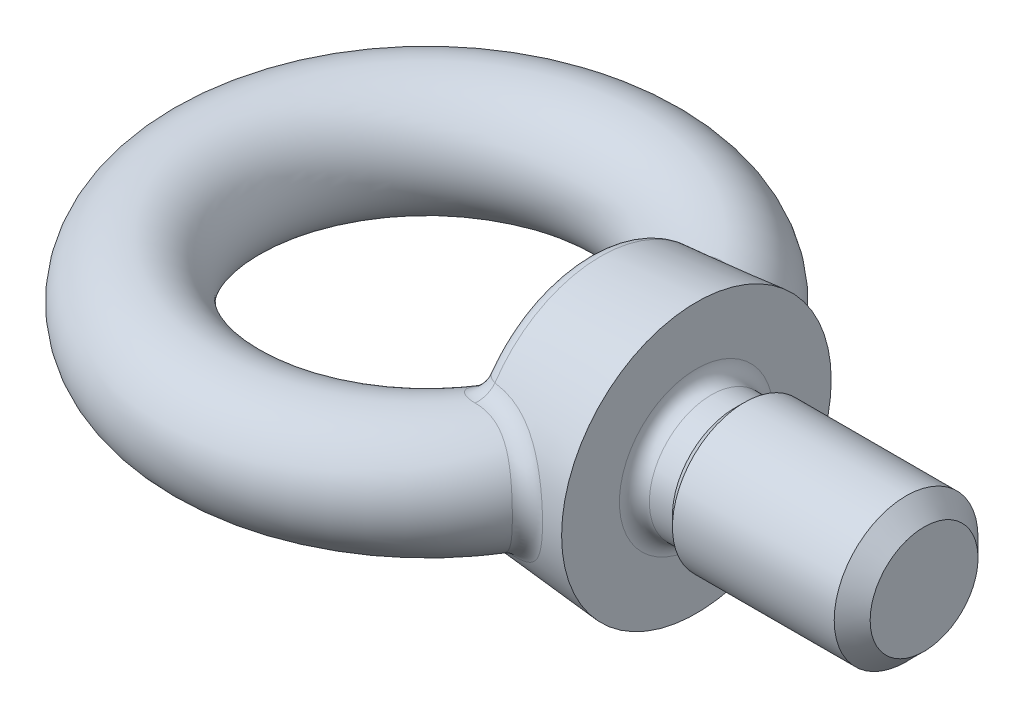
SolidWorks part; units mm, degrees
ref_plane "Front Plane" through (0, 0, 0) normal (0, 0, 1) x (1, 0, 0)
ref_plane "Top Plane" through (0, 0, 0) normal (0, 1, 0) x (1, 0, 0)
ref_plane "Right Plane" through (0, 0, 0) normal (1, 0, 0) x (0, 0, -1)
other "Configuration Table"
sketch "BaseBodySke" plane through (0, 0, 0) normal (0, 0, 1) x (1, 0, 0)
  line L0 (-107.4075, 0) -> (214.0904, 0) construction
  line L1 (0, 0) -> (0, 10.352)
  line L2 (8, 12) -> (6.352, 10.352)
  line L3 (6.352, 10.352) -> (0, 10.352)
  line L4 (8, 12) -> (38, 12)
  line L5 (38, 12) -> (38, 0)
  line L6 (38, 0) -> (0, 0)
  line L7 (8, 24.2031) -> (8, -17.9005) construction
  line L8 (34.0602, 10.352) -> (57.5082, 10.352) construction
  line L9 (35, 13.8049) -> (35, -14.5195) construction
revolve "BaseBody" add sketch "BaseBodySke" angle 360 about L6
sketch "HeadBaseSke" plane through (0, 0, 0) normal (0, 0, 1) x (1, 0, 0)
  line L0 (0, 0) -> (-36.296, 0) construction
  line L1 (-18, 20.9252) -> (0, 22.5)
  line L2 (-20, 0) -> (0, 0)
  line L3 (-45, 33.5024) -> (-45, -15.844) construction
  line L4 (0, 22.5) -> (0, 0)
  line L5 (-20, 0) -> (-18, 20.9252)
revolve "HeadBase" add sketch "HeadBaseSke" angle 360 about L0
sketch "RingSke" plane through (0, 0, 0) normal (0, 0, 1) x (1, 0, 0)
  line L0 (-45, 45.564) -> (-45, -44.2909) construction
  line L1 (0, 29.3194) -> (0, -32.008) construction
  circle A0 centre (-10, 0) radius 10
revolve "Ring" add sketch "RingSke" angle 360 about L0
sketch "FlatEndSke" plane through (0, 0, 0) normal (0, 0, 1) x (1, 0, 0)
  line L0 (35, 12) -> (38, 12)
  line L1 (38, 12) -> (38, 9)
  line L2 (38, 9) -> (35, 12)
  line L3 (38, -12) -> (38, 12) construction
  line L5 (0, 0) -> (89.7899, 0) construction
revolve "FlatEnd" cut sketch "FlatEndSke" angle 360 about L5
sketch "CutEndSke" plane through (38, 0, 0) normal (1, 0, 0) x (0, 0, -1)
  circle A0 centre (0, 0) radius 12 construction
  circle A1 centre (0, 0) radius 12
extrude "CutEnd" [suppressed] cut sketch "CutEndSke" against normal blind 3
dome "RoundEnd" [suppressed] faces to dome 1 distance 3 parameters "D1"=3
fillet "Fillet1" radius 2.4 6 edges at (-18, 20.9252, 0) (-18, -20.9252, 0) (-19.811, 1.9468, -0.3451) (-19.811, -1.9468, 0.3451) (-5.8247, -1.3824, 21.9469) (-5.8247, 1.3824, -21.9469)
fillet "Fillet2" radius 3.6 8 edges at (-17.4293, 9.7808, 17.9838) (-17.5159, 9.7551, -17.9021) (-19.811, 1.9468, -0.3451) (-5.8247, -1.3824, 21.9469) (-5.8247, 1.3824, -21.9469) (-17.5159, -9.7551, 17.9021) (-17.4293, -9.7808, -17.9838) (-19.811, -1.9468, 0.3451)
fillet "Fillet" radius 2.5 1 edges at (0, 0, -10.352)
sketch "ThdSchSke" plane through (0, 0, 0) normal (0, 0, 1) x (1, 0, 0)
  line L0 (0, 0) -> (89.8666, 0) construction
  line L1 (38, -27.1828) -> (38, 30.5493) construction
  line L2 (35, 10.352) -> (34.0485, 12)
  line L3 (34.0485, 12) -> (34.0485, 13.9029)
  line L4 (34.0485, 13.9029) -> (35.9515, 13.9029)
  line L5 (35.9515, 13.9029) -> (35.9515, 12)
  line L6 (35.9515, 12) -> (35, 10.352)
revolve "ThreadSchematic" [suppressed] cut sketch "ThdSchSke" angle 360 about L0
pattern_linear "ThdSchPat" [suppressed] count 10 spacing 3 along (1, 0, 0)
equation "\"Thread_length@BaseBodySke\" = \"Length@BaseBodySke\" - \"Slot_width@BaseBodySke\""
equation "\"Thread_minor@ThreadCosmetic\" = \"Minor_dia@BaseBodySke\""
equation "\"Thread_length@ThreadCosmetic\" = \"Thread_length@BaseBodySke\""
equation "\"D1@RingSke\" = \"Center_height@HeadBaseSke\""
equation "\"D1@CutEnd\" = \"Chamfer_width@FlatEndSke\""
equation "\"D1@RoundEnd\" = \"Chamfer_width@FlatEndSke\""
equation "\"D1@Fillet1\" = \"Diameter@BaseBodySke\"/10"
equation "\"D1@Fillet2\" = \"D1@Fillet1\"*1.5"
equation "\"Length@ThdSchSke\" = \"Length@BaseBodySke\""
equation "\"Advance@ThdSchSke\" = \"Advance@BaseBodySke\""
equation "\"D2@ThdSchSke\" = \"Diameter@BaseBodySke\""
equation "\"D1@ThdSchSke\" = \"Minor_dia@BaseBodySke\""
equation "\"D3@ThdSchPat\" = \"Advance@BaseBodySke\""
equation "\"D1@ThdSchPat\" =  int( \"Thread_length@BaseBodySke\" / \"Advance@BaseBodySke\" ) "
